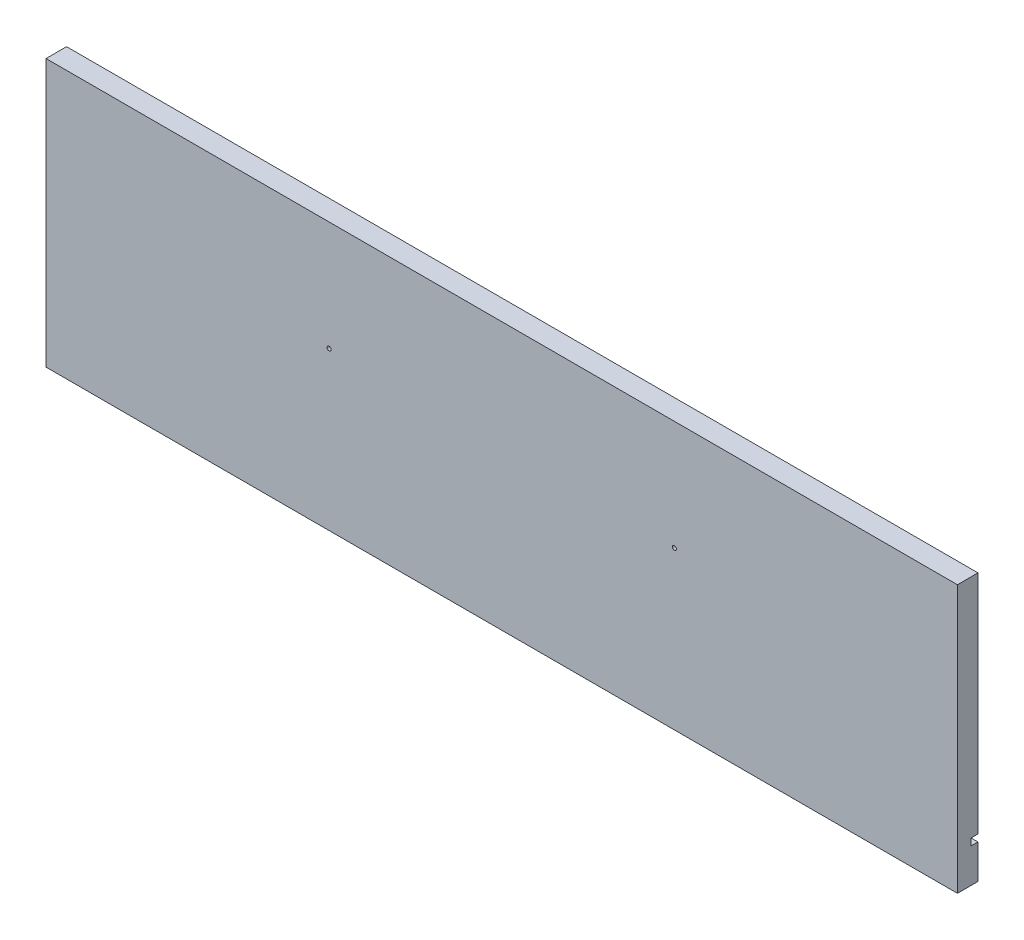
SolidWorks part; units mm, degrees
ref_plane "Front" through (0, 0, 0) normal (0, 0, 1) x (1, 0, 0)
ref_plane "Top" through (0, 0, 0) normal (0, 1, 0) x (1, 0, 0)
ref_plane "Right" through (0, 0, 0) normal (1, 0, 0) x (0, 0, -1)
sketch "Sketch1" plane through (0, 0, 0) normal (0, 0, 1) x (1, 0, 0)
  line L1 (-332.5, 0) -> (332.5, 0)
  line L2 (-332.5, 0) -> (-332.5, 195)
  line L3 (-332.5, 195) -> (332.5, 195)
  line L4 (332.5, 0) -> (332.5, 195)
  point P4 (0, 0)
  dimension "D1" = 665
  dimension "D2" = 195
extrude "Base-Extrude" add sketch "Sketch1" against normal blind 15
sketch "Sketch2" plane through (332.5, 0, 0) normal (1, 0, 0) x (0, 0, -1)
  line L0 (15, 0) -> (15, 195) construction
  line L1 (15, 25) -> (10, 25)
  line L2 (15, 25) -> (15, 30)
  line L3 (15, 30) -> (10, 30)
  line L4 (10, 25) -> (10, 30)
  line L5 (15, 0) -> (0, 0) construction
  dimension "D1" = 25
  dimension "D2" = 5
  dimension "D3" = 5
extrude "Cut-Extrude1" cut sketch "Sketch2" against normal through all
hole_wizard "M3.0 (3.000000) Diameter Hole1" positions "Sketch7" profile "Sketch8" hole size "M3.0" standard "Ansi Metric"
sketch "Sketch7" plane through (0, 0, 0) normal (0, 0, 1) x (1, 0, 0)
  line L1 (0, 0) -> (0, 195) construction
  line L2 (332.5, 115) -> (-332.5, 115)
  line L3 (332.5, 115) -> (-332.5, 115) construction
  line L4 (332.5, 195) -> (-332.5, 195) construction
  line L5 (-332.5, 195) -> (-332.5, 0) construction
  point P0 (-126, 115)
  point P8 (126, 115)
  dimension "D2" = 206.5
  dimension "D3" = 252
  dimension "D1" = 80
sketch "Sketch8" plane through (-126, 115, 0) normal (1, 0, 0) x (0, -1, 0)
  line L0 (0, 0) -> (0, 15)
  line L1 (0, 15) -> (1.5, 15)
  line L2 (1.5, 15) -> (1.5, 0)
  line L5 (1.5, 0) -> (0, 0)
  line L11 (0, -6.35) -> (0, 107.95) construction
  dimension "Thru Hole Dia." = 3
  dimension "Thru Hole Depth" = 15
hole_wizard "M3.0 (3.000000) Diameter Hole2" positions "Sketch10" profile "Sketch9" hole size "M3.0" standard "Ansi Metric"
sketch "Sketch10" plane through (0, 0, -15) normal (0, 0, -1) x (-1, 0, 0)
  point P1 (-325, 135)
  point P2 (-325, 45)
  point P4 (325, 135)
  point P6 (325, 45)
sketch "Sketch9" plane through (325, 135, -15) normal (1, 0, 0) x (0, 1, 0)
  line L0 (0, 0) -> (0, 10.9013)
  line L1 (0, 10.9013) -> (1.5, 10)
  line L2 (1.5, 10) -> (1.5, 0)
  line L5 (1.5, 0) -> (0, 0)
  line L10 (0, 10.9013) -> (-1.5, 10) construction
  line L11 (0, -6.35) -> (0, 107.95) construction
  dimension "Hole Dia." = 3
  dimension "Hole Depth" = 10
  dimension "Drill Angle" = 118
